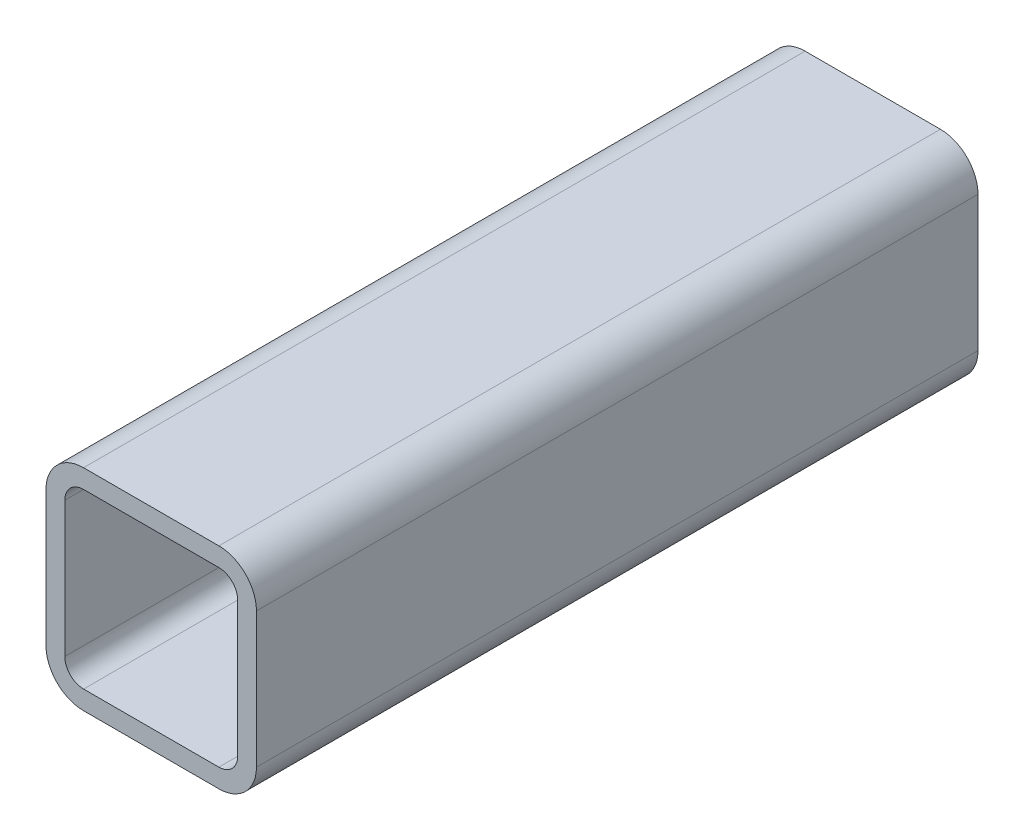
SolidWorks part; units mm, degrees
ref_plane "Front Plane" through (0, 0, 0) normal (0, 0, 1) x (1, 0, 0)
ref_plane "Top Plane" through (0, 0, 0) normal (0, 1, 0) x (1, 0, 0)
ref_plane "Right Plane" through (0, 0, 0) normal (1, 0, 0) x (0, 0, -1)
sketch "Sketch1" plane through (0, 0, 0) normal (0, 0, 1) x (1, 0, 0)
sketch_block_instance "HSS3.5x3.5x0.3125-1"
sketch_block "HSS3.5x3.5x0.3125"
extrude "Boss-Extrude1" add sketch "Sketch1" along normal blind 304.8
